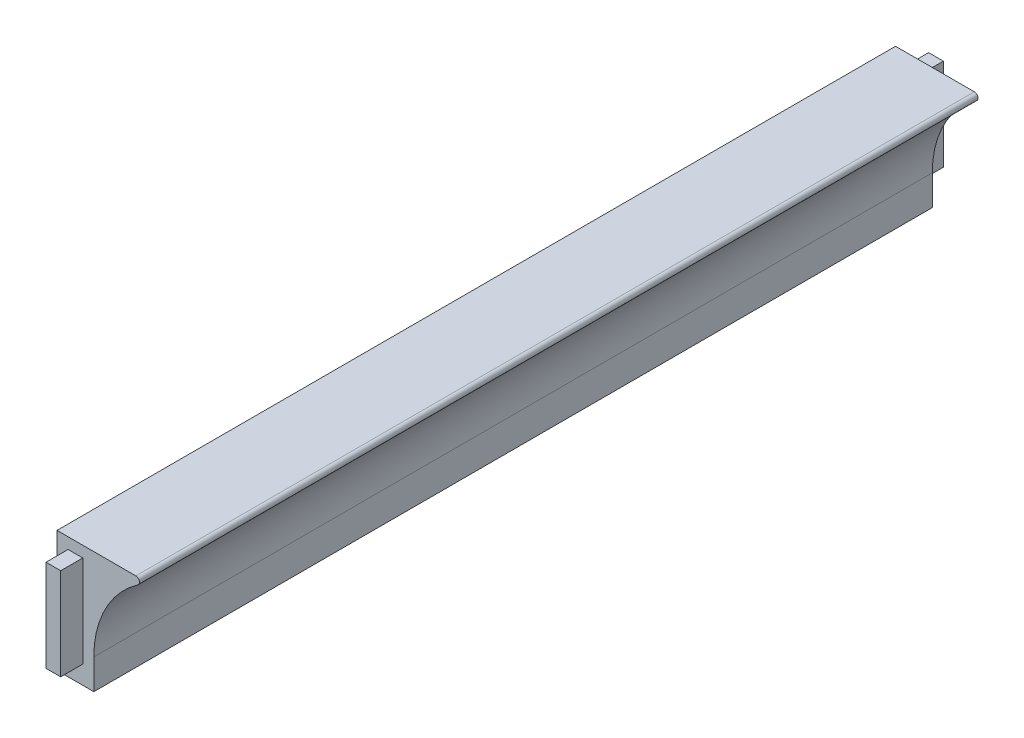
SolidWorks part; units mm, degrees
ref_plane "Front Plane" through (0, 0, 0) normal (0, 0, 1) x (1, 0, 0)
ref_plane "Top Plane" through (0, 0, 0) normal (0, 1, 0) x (1, 0, 0)
ref_plane "Right Plane" through (0, 0, 0) normal (1, 0, 0) x (0, 0, -1)
sketch "Sketch1" plane through (0, 0, 0) normal (0, 0, 1) x (1, 0, 0)
  line L0 (0, 0) -> (-25, 0)
  line L1 (-25, 0) -> (-25, -33)
  line L2 (-25, -33) -> (-15, -33)
  line L3 (-15, -33) -> (-15, -24.7992)
  arc A0 (-15, -24.7992) -> (0, 0) centre (13, -24.7992) cw
  dimension "D4" = 28
  dimension "D1" = 33
  dimension "D2" = 25
  dimension "D3" = 10
extrude "Boss-Extrude1" add sketch "Sketch1" along normal mid plane 228
sketch "Sketch2" plane through (0, 0, 114) normal (0, 0, 1) x (1, 0, 0)
  line L0 (0, 0) -> (-25, 0) construction
  line L1 (-22, -3) -> (-18, -3)
  line L2 (-22, -3) -> (-22, -28)
  line L3 (-22, -28) -> (-18, -28)
  line L4 (-18, -3) -> (-18, -28)
  line L5 (-25, 0) -> (-25, -33) construction
  dimension "D1" = 4
  dimension "D2" = 25
  dimension "D3" = 3
  dimension "D4" = 3
extrude "Boss-Extrude2" add sketch "Sketch2" along normal blind 6
mirror "Mirror1" about plane through (0, 0, 0) normal (0, 0, 1) of "Boss-Extrude2"
fillet "Fillet1" radius 1 1 edges at (0, 0, 0)
